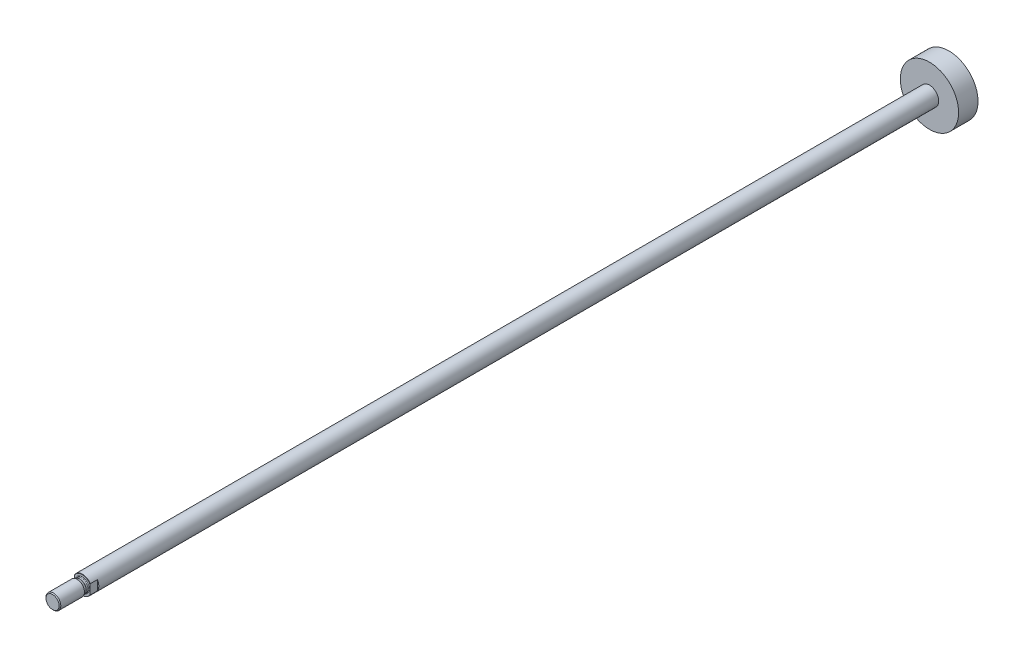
SolidWorks part; units mm, degrees
ref_plane "Plano frontal" through (0, 0, 0) normal (0, 0, 1) x (1, 0, 0)
ref_plane "Plano superior" through (0, 0, 0) normal (0, 1, 0) x (1, 0, 0)
ref_plane "Plano direito" through (0, 0, 0) normal (1, 0, 0) x (0, 0, -1)
imported_body "Bruto-CPME63-700-1"
sketch "Esboço1" plane through (0, 0, 0) normal (1, 0, 0) x (0, 0, -1)
  line L1 (143.0432, 21.2302) -> (153.9331, 21.2302)
  line L2 (143.0432, 21.2302) -> (143.0432, -25.9594)
  line L3 (143.0432, -25.9594) -> (153.9331, -25.9594)
  line L4 (153.9331, 21.2302) -> (153.9331, -25.9594)
extrude "Corte-extrusão1" cut sketch "Esboço1" against normal through all both and the other way through all
move or copy body "Corpo-Mover/Copiar1" bodies to move or copy 103 copy no translate (0, 0, 320)
sketch "Esboço2" plane through (0, 0, 176.9568) normal (0, 0, -1) x (-1, 0, 0)
  circle A1 centre (0, 0) radius 10
  circle A2 centre (0, 0) radius 10
  dimension "D1" = 0
extrude "Ressalto-extrusão1" add sketch "Esboço2" along normal up to next
